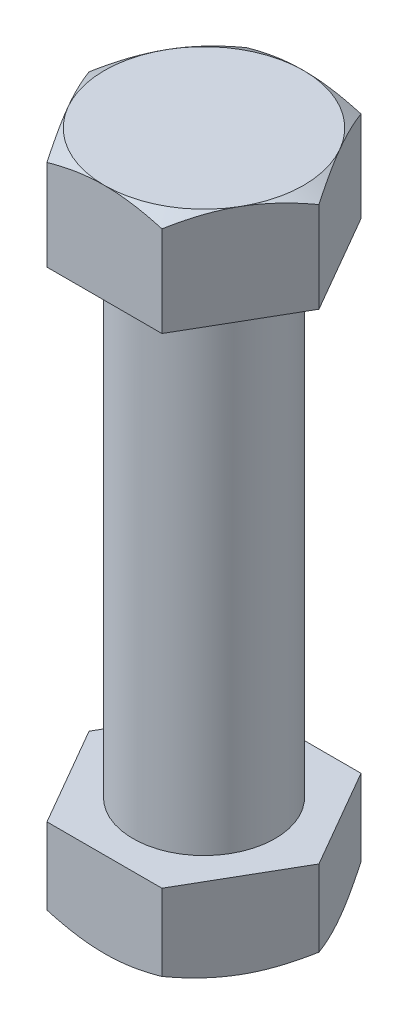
SolidWorks part; units mm, degrees
ref_plane "Face" through (0, 0, 0) normal (0, 0, 1) x (1, 0, 0)
ref_plane "Dessus" through (0, 0, 0) normal (0, 1, 0) x (1, 0, 0)
ref_plane "Droite" through (0, 0, 0) normal (1, 0, 0) x (0, 0, -1)
imported_body "bolt_type_anchor_shackles_1019533"
sketch "Sketch1" plane through (0, 60.68, 0) normal (0, 1, 0) x (1, 0, 0)
  circle A0 centre (0, 0) radius 44.4613
extrude "Cut-Extrude1" cut sketch "Sketch1" along normal blind 40
sketch "Sketch2" plane through (0, 60.68, 0) normal (0, 1, 0) x (1, 0, 0)
  circle A0 centre (0, 0) radius 12.7 construction
  circle A1 centre (0, 0) radius 12.7
extrude "Boss-Extrude1" add sketch "Sketch2" against normal blind 6
